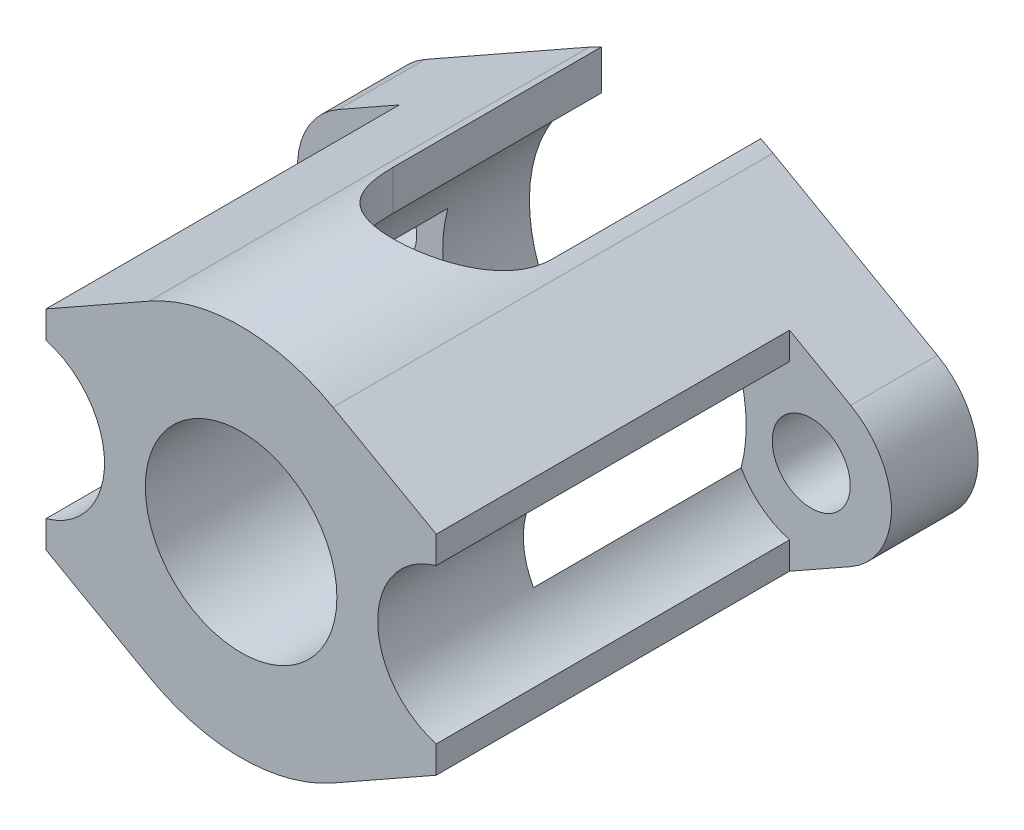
SolidWorks part; units mm, degrees
ref_plane "Front Plane" through (0, 0, 0) normal (0, 0, 1) x (1, 0, 0)
ref_plane "Top Plane" through (0, 0, 0) normal (0, 1, 0) x (1, 0, 0)
ref_plane "Right Plane" through (0, 0, 0) normal (1, 0, 0) x (0, 0, -1)
sketch "Sketch1" plane through (0, 0, 0) normal (0, 0, 1) x (1, 0, 0)
  line L0 (0, 10.9474) -> (0, -38.8709) construction
  line L1 (5.3861, 9.5308) -> (15.0119, 4.0909)
  line L2 (-5.3861, 9.5308) -> (-15.0119, 4.0909)
  line L3 (0, 0) -> (17.399, 0) construction
  line L4 (5.3861, -9.5308) -> (15.0119, -4.0909)
  line L5 (-5.3861, -9.5308) -> (-15.0119, -4.0909)
  arc A0 (5.3861, 9.5308) -> (-5.3861, 9.5308) centre (0, 0) ccw
  arc A1 (15.0119, -4.0909) -> (15.0119, 4.0909) centre (12.7, 0) ccw
  circle A2 centre (12.7, 0) radius 2.286
  circle A3 centre (0, 0) radius 5.6134
  arc A4 (-15.0119, -4.0909) -> (-15.0119, 4.0909) centre (-12.7, 0) cw
  arc A5 (5.3861, -9.5308) -> (-5.3861, -9.5308) centre (0, 0) cw
  circle A6 centre (-12.7, 0) radius 2.286
  dimension "D1" = 4.572
  dimension "D2" = 25.4
  dimension "D3" = 21.8948
  dimension "D5" = 11.2268
  dimension "D4" = 34.798
extrude "Boss-Extrude1" add sketch "Sketch1" along normal blind 25.781
sketch "Sketch2" plane through (0, 0, 0) normal (0, 0, -1) x (-1, 0, 0)
  circle A0 centre (0, 0) radius 8.89
  dimension "D1" = 17.78
extrude "Cut-Extrude1" cut sketch "Sketch2" against normal blind 17.2466
sketch "Sketch3" plane through (0, 0, 0) normal (0, 1, 0) x (1, 0, 0)
  line L0 (0, 0) -> (0, -12.2301) construction
  line L1 (0, 0) -> (4.6609, 0)
  line L2 (4.6609, 0) -> (4.6609, -12.2301)
  line L3 (0, -16.891) -> (0, -12.2301) construction
  line L4 (-4.6609, -12.2301) -> (-4.6609, 0)
  line L5 (-4.6609, 0) -> (0, 0)
  arc A0 (-4.6609, -12.2301) -> (4.6609, -12.2301) centre (0, -12.2301) ccw
  dimension "D1" = 4.6609
  dimension "D2" = 16.891
extrude "Cut-Extrude2" cut sketch "Sketch3" against normal through all and the other way through all
sketch "Sketch4" plane through (0, 0, 25.781) normal (0, 0, 1) x (1, 0, 0)
  line L0 (-11.43, -9.3596) -> (-11.43, -4.5241)
  line L1 (11.43, -9.3596) -> (11.43, -4.5241)
  line L2 (0, 0) -> (-18.5067, 0) construction
  line L3 (0, 0) -> (0, 11.4911) construction
  line L4 (-11.43, 4.5241) -> (-11.43, 9.3596)
  line L5 (11.43, 4.5241) -> (11.43, 9.3596)
  arc A0 (-11.43, -4.5241) -> (-11.43, 4.5241) centre (-12.7, 0) ccw
  arc A1 (-11.43, 9.3596) -> (-11.43, -9.3596) centre (-12.7, 0) ccw
  arc A2 (-15.0119, 4.0909) -> (-15.0119, -4.0909) centre (-12.7, 0) ccw construction
  arc A3 (11.43, 9.3596) -> (11.43, -9.3596) centre (12.7, 0) cw
  arc A4 (11.43, -4.5241) -> (11.43, 4.5241) centre (12.7, 0) cw
  dimension "D1" = 22.86
extrude "Cut-Extrude3" cut sketch "Sketch4" against normal offset from surface (20.701 mm away) 5.08
hole_wizard "CSK for #8 Flat Head Machine Screw1" positions "Sketch6" profile "Sketch5" countersink size "#8" standard "ANSI Inch"
sketch "Sketch6" plane through (0, 0, 5.08) normal (0, 0, 1) x (1, 0, 0)
  point P0 (-12.7, 0)
  point P3 (12.7, 0)
sketch "Sketch5" plane through (-12.7, 0, 5.08) normal (1, 0, 0) x (0, -1, 0)
  line L0 (0, 0) -> (0, 5.08)
  line L1 (0, 5.08) -> (2.1526, 5.08)
  line L2 (2.1526, 5.08) -> (2.1526, 2.3741)
  line L3 (2.1526, 2.3741) -> (4.2164, 0)
  line L5 (4.2164, 0) -> (0, 0)
  line L6 (-2.1526, 2.3741) -> (-4.2164, 0) construction
  line L11 (0, -6.35) -> (0, 107.95) construction
  dimension "Thru Hole Dia." = 4.3053
  dimension "Thru Hole Depth" = 5.08
  dimension "Near C'Sink Dia." = 8.4328
  dimension "Near C'Sink Angle" = 82
sketch "Sketch7" plane through (0, 0, 25.781) normal (0, 0, 1) x (1, 0, 0)
  line L0 (15.24, 6.9904) -> (15.24, -6.9904)
  line L1 (0, 0) -> (0, 13.5376) construction
  line L2 (-15.24, 6.9904) -> (-15.24, -6.9904)
  arc A0 (15.24, -6.9904) -> (15.24, 6.9904) centre (12.7, 0) ccw
  circle A1 centre (12.7, 0) radius 2.286 construction
  arc A2 (-15.24, -6.9904) -> (-15.24, 6.9904) centre (-12.7, 0) cw
  dimension "D1" = 30.48
extrude "Cut-Extrude4" [suppressed] cut sketch "Sketch7" against normal through all
